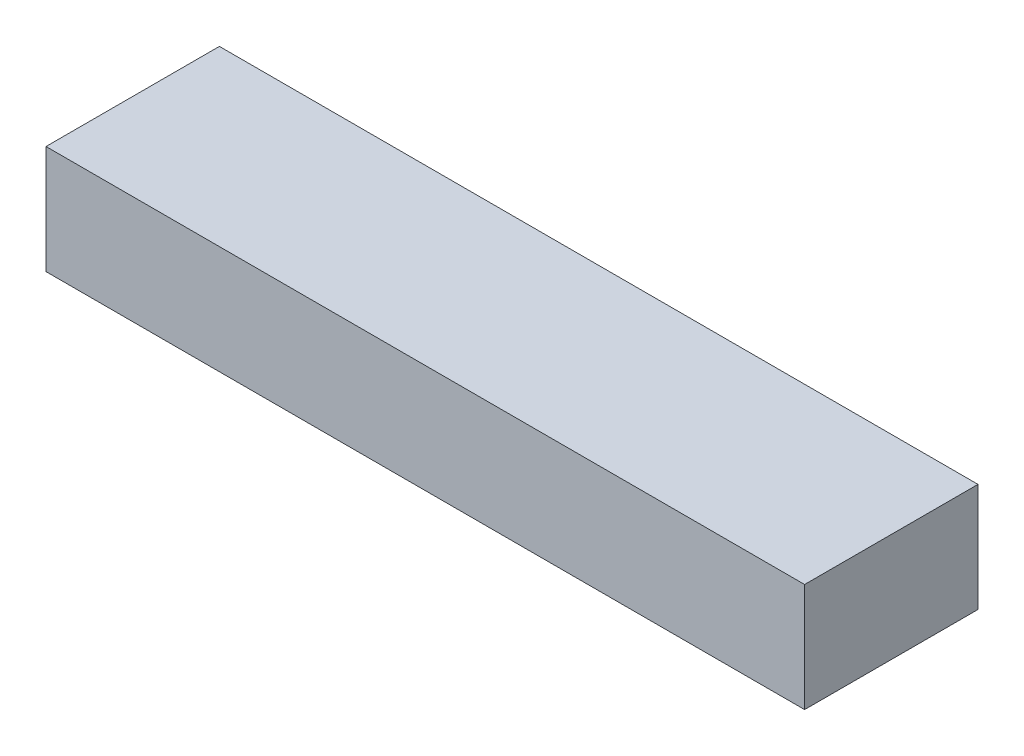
SolidWorks part; units mm, degrees
ref_plane "Plan de face" through (0, 0, 0) normal (0, 0, 1) x (1, 0, 0)
ref_plane "Plan de dessus" through (0, 0, 0) normal (0, 1, 0) x (1, 0, 0)
ref_plane "Plan de droite" through (0, 0, 0) normal (1, 0, 0) x (0, 0, -1)
sketch "Esquisse1" plane through (0, 0, 0) normal (0, 0, 1) x (1, 0, 0)
  line L1 (0, 0) -> (35, 0)
  line L2 (0, 0) -> (0, 5)
  line L3 (0, 5) -> (35, 5)
  line L4 (35, 0) -> (35, 5)
  dimension "D1" = 35
  dimension "D2" = 5
extrude "Extrusion1" add sketch "Esquisse1" along normal blind 8
